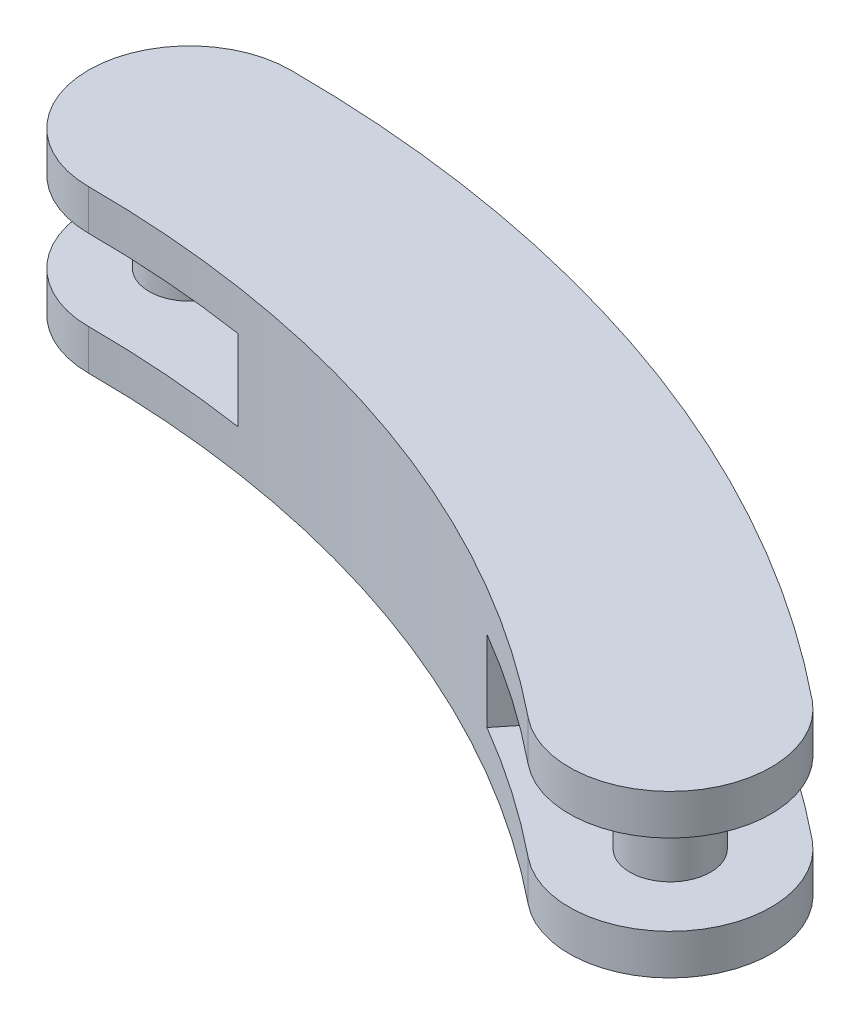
SolidWorks part; units mm, degrees
ref_plane "Front Plane" through (0, 0, 0) normal (0, 0, 1) x (1, 0, 0)
ref_plane "Top Plane" through (0, 0, 0) normal (0, 1, 0) x (1, 0, 0)
ref_plane "Right Plane" through (0, 0, 0) normal (1, 0, 0) x (0, 0, -1)
sketch "Sketch1" plane through (0, 0, 0) normal (0, 1, 0) x (1, 0, 0)
  line L0 (0, 0) -> (184, 0) construction
  line L2 (0, 65) -> (-50.7559, 65) construction
  line L3 (0, 0) -> (0, 65) construction
  arc A1 (0, 40) -> (168.2966, -19.4526) centre (0, -227.9308) cw
  arc A2 (0, 90) -> (199.7034, 19.4526) centre (0, -227.9308) cw
  arc A3 (0, 90) -> (0, 40) centre (0, 65) ccw
  arc A4 (168.2966, -19.4526) -> (199.7034, 19.4526) centre (184, 0) ccw
  circle A5 centre (0, 65) radius 10
  circle A6 centre (184, 0) radius 10
  dimension "D5" = 50
  dimension "D6" = 20
  dimension "D1" = 184
  dimension "D2" = 65
sketch "Sketch2" plane through (0, 0, 0) normal (0, 1, 0) x (1, 0, 0)
extrude "Boss-Extrude1" add sketch "Sketch1" along normal blind 40
sketch "Sketch3" plane through (0, 0, 0) normal (0, 0, 1) x (1, 0, 0)
  line L0 (0, 40) -> (-25, 40) construction
  line L1 (-25, 30) -> (40, 30)
  line L2 (-25, 30) -> (-25, 10)
  line L3 (-25, 10) -> (40, 10)
  line L4 (40, 30) -> (40, 10)
  line L5 (-25, 40) -> (-25, 0) construction
  dimension "D1" = 20
  dimension "D2" = 10
  dimension "D3" = 65
sketch "Sketch4" plane through (0, 40, 0) normal (0, 1, 0) x (1, 0, 0)
  line L0 (168.2966, -19.4526) -> (199.7034, 19.4526) construction
ref_plane "Plane1" through (168.2966, 40, 19.4526) normal (0.6281, 0, -0.7781) x (-0.7781, 0, -0.6281)
sketch "Sketch5" plane through (168.2966, 40, 19.4526) normal (0.6281, 0, -0.7781) x (-0.7781, 0, -0.6281)
  line L0 (0, 0) -> (-25, 0) construction
  line L1 (40, -10) -> (-78.7261, -10)
  line L2 (40, -10) -> (40, -30)
  line L3 (40, -30) -> (-78.7261, -30)
  line L4 (-78.7261, -10) -> (-78.7261, -30)
  dimension "D1" = 20
  dimension "D2" = 10
extrude "Cut-Extrude1" cut sketch "Sketch3" against normal through all contours L2 L3 L4 L1
extrude "Cut-Extrude2" cut sketch "Sketch5" along normal through all and the other way up to next contours L3 L4 L1 L2
sketch "Sketch14" plane through (0, 40, 0) normal (0, 1, 0) x (1, 0, 0)
  line L0 (168.2966, -19.4526) -> (199.7034, 19.4526) construction
  circle A0 centre (0, 65) radius 10
  circle A1 centre (184, 0) radius 10
extrude "Boss-Extrude2" add sketch "Sketch14" against normal through all
